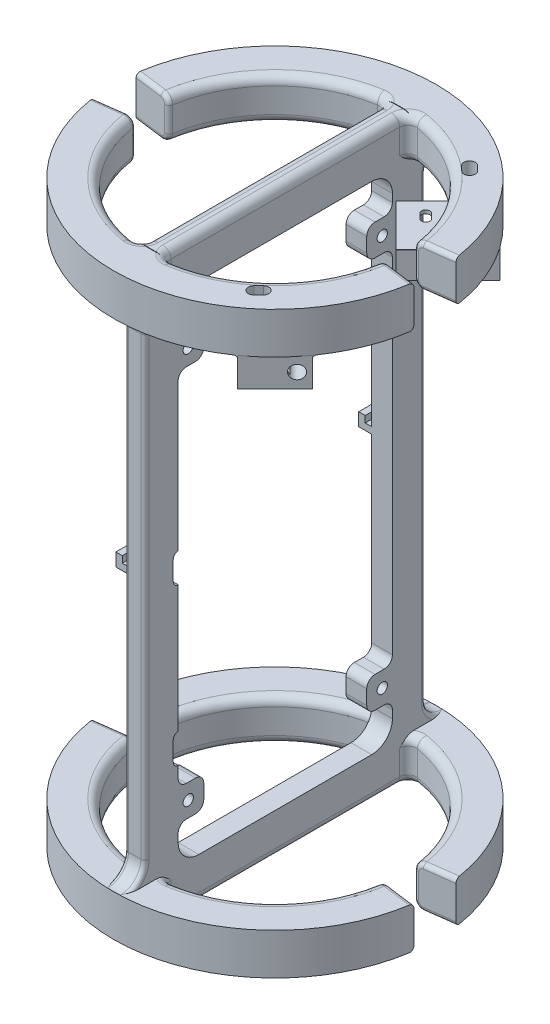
SolidWorks part; units mm, degrees
ref_plane "Front Plane" through (0, 0, 0) normal (0, 0, 1) x (1, 0, 0)
ref_plane "Top Plane" through (0, 0, 0) normal (0, 1, 0) x (1, 0, 0)
ref_plane "Right Plane" through (0, 0, 0) normal (1, 0, 0) x (0, 0, -1)
imported_body "20190209_Avionics_FrameV2-1-solid1"
imported_body "holderV2-2-solid1"
imported_body "holderV2-3-solid1"
combine bodies "Combine1" operation type add bodies to combine 103 101
combine bodies "Combine2" operation type add bodies to combine 102 104
sketch "Sketch3" plane through (0, 173.4347, 0) normal (0, -1, 0) x (-1, 0, 0)
  line L0 (-39.4151, -193.4782) -> (-41.214, -195.277) construction
  line L1 (-37.9783, -194.915) -> (-39.7743, -196.7111) construction
  line L2 (-39.7743, -196.7111) -> (-41.214, -195.277)
  line L3 (-37.9783, -194.915) -> (-39.4151, -193.4782)
  arc A1 (-39.4151, -193.4782) -> (-41.1403, -195.3451) centre (-40.3145, -194.3776) ccw construction
  arc A2 (-39.7743, -196.7111) -> (-37.9783, -194.915) centre (-38.8763, -195.813) ccw construction
  circle A3 centre (-40.3145, -194.3776) radius 1.272
  circle A4 centre (-38.8763, -195.813) radius 1.27
extrude "Cut-Extrude1" cut sketch "Sketch3" against normal blind 15 contours A4 A3 M5 | A4 A3 M6 | A4 A3 M3
sketch "Sketch4" plane through (0, 186.1347, 0) normal (0, 1, 0) x (1, 0, 0)
  line L0 (37.9783, -194.915) -> (39.7743, -196.7111) construction
  line L1 (41.1403, -195.3451) -> (39.4151, -193.4782) construction
  line L2 (39.7743, -196.7111) -> (40.1137, -197.0505)
  line L3 (37.9783, -194.915) -> (37.6389, -194.5756)
  line L4 (41.1403, -195.3451) -> (41.4654, -195.6969)
  line L5 (39.4151, -193.4782) -> (39.09, -193.1264)
  line L6 (37.6389, -194.5756) -> (39.09, -193.1264)
  line L7 (40.1137, -197.0505) -> (41.4654, -195.6969)
  circle A0 centre (40.2777, -194.4116) radius 1.75
  circle A1 centre (38.8763, -195.813) radius 1.75
  dimension "D1" = 3.5
  dimension "D2" = 3.5
extrude "Cut-Extrude2" cut sketch "Sketch4" against normal blind 5 contours A1 L7 A0 | L3 A1 L2 M4 | L2 A1 A0 M3 | A1 A0 L4 M3 | A0 A1 M3 | A0 A1 L3 M5 | A1 A0 L6 | L4 A0 L5 M2 | A1 A0 M5 | A1 L5 L6 A0 M5
sketch "Sketch8" plane through (0, 173.4347, 0) normal (0, -1, 0) x (-1, 0, 0)
  line L0 (-37.8885, -130.4266) -> (-39.6845, -128.6306) construction
  line L1 (-39.2544, -131.7926) -> (-41.1386, -130.085) construction
  line L2 (-37.8885, -130.4266) -> (-39.2544, -131.7926)
  line L3 (-39.6845, -128.6306) -> (-41.1386, -130.085)
  arc A0 (-37.8885, -130.4266) -> (-39.6845, -128.6306) centre (-38.7865, -129.5286) ccw construction
  arc A2 (-41.1214, -130.0674) -> (-39.2544, -131.7926) centre (-40.2219, -130.9668) ccw construction
  circle A3 centre (-38.7865, -129.5286) radius 1.27
  circle A4 centre (-40.1965, -130.9388) radius 1.2714
extrude "Cut-Extrude3" cut sketch "Sketch8" against normal blind 15 contours A4 A3 M3 | A4 A3 M4 | A3 A4 | L3 A4 A3 | A4 A3 L3
sketch "Sketch9" plane through (0, 186.1347, 0) normal (0, 1, 0) x (1, 0, 0)
  line L0 (39.6845, -128.6306) -> (37.8885, -130.4266) construction
  line L1 (39.2544, -131.7926) -> (41.1386, -130.085) construction
  line L2 (39.6845, -128.6306) -> (40.0239, -128.2912)
  line L3 (37.8885, -130.4266) -> (37.5491, -130.766)
  line L4 (41.1386, -130.085) -> (41.4932, -129.7636)
  line L5 (39.2544, -131.7926) -> (38.8998, -132.114)
  line L6 (40.0239, -128.2912) -> (41.4932, -129.7636)
  line L7 (37.5491, -130.766) -> (38.8998, -132.114)
  circle A0 centre (38.7865, -129.5286) radius 1.75
  circle A1 centre (40.1965, -130.9388) radius 1.75
  dimension "D1" = 3.5
  dimension "D2" = 3.5
extrude "Cut-Extrude4" cut sketch "Sketch9" against normal blind 5 contours L2 A0 L3 M3 | A1 L3 A0 M6 | A1 A0 L7 M13 | A0 A1 L5 M13 M6 | A1 A0 M6 | A1 L4 L5 M13 M5 | L6 A1 A0 L4 M4 | A1 L6 A0 | A0 A1 M4 | A1 A0 L2 M4
sketch "Sketch11" plane through (8.9463, 0, 0) normal (-1, 0, 0) x (0, 0, 1)
  line L0 (131.2599, 157.3692) -> (120.8459, 157.3692)
  line L1 (120.8459, 167.0847) -> (120.8459, 27.3847) construction
  line L2 (193.9979, 157.3692) -> (204.4059, 157.3692)
  line L3 (204.4059, 27.3847) -> (204.4059, 167.0847) construction
  line L4 (129.7359, 150.0667) -> (129.7359, 44.4027) construction
  line L5 (129.7359, 101.8692) -> (120.7359, 101.8692)
  line L6 (129.7359, 101.8692) -> (129.7359, 99.8692)
  line L7 (129.7359, 99.8692) -> (120.7359, 99.8692)
  line L8 (120.7359, 101.8692) -> (120.7359, 99.8692)
  line L11 (197.1725, 99.8692) -> (204.3027, 99.8692)
  line L12 (197.1725, 99.8692) -> (197.1725, 101.8692)
  line L13 (197.1725, 101.8692) -> (204.3027, 101.8692)
  line L14 (204.3027, 99.8692) -> (204.3027, 101.8692)
  circle A0 centre (132.8474, 157.3692) radius 1.5875 construction
  circle A1 centre (192.4104, 157.3692) radius 1.5875 construction
  dimension "D1" = 55.5
  dimension "D2" = 2
  dimension "D3" = 55.5
  dimension "D4" = 2
  dimension "D5" = 9
extrude "Boss-Extrude1" add sketch "Sketch11" along normal blind 4 contours L11 L14 L13 L12 | L5 L8 L7 L6
sketch "Sketch12" plane through (0, 101.8692, 0) normal (0, 1, 0) x (1, 0, 0)
  line L0 (4.9463, -129.7359) -> (8.9463, -129.7359) construction
  line L1 (4.9463, -120.7359) -> (6.9463, -120.7359)
  line L2 (4.9463, -120.7359) -> (4.9463, -129.7359)
  line L3 (4.9463, -129.7359) -> (6.9463, -129.7359)
  line L4 (6.9463, -120.7359) -> (6.9463, -129.7359)
  line L5 (4.9463, -204.3027) -> (8.9463, -204.3027) construction
  line L6 (4.9463, -197.1725) -> (6.9463, -197.1725)
  line L7 (4.9463, -197.1725) -> (4.9463, -204.3027)
  line L8 (4.9463, -204.3027) -> (6.9463, -204.3027)
  line L9 (6.9463, -197.1725) -> (6.9463, -204.3027)
  dimension "D1" = 2
extrude "Boss-Extrude2" add sketch "Sketch12" along normal blind 2
fillet "Fillet1" radius 1 4 edges at (37.7461, 173.4347, 199.7118) (49.2071, 173.4347, 188.2507) (37.7461, 173.4347, 125.5401) (49.2071, 173.4347, 137.0011)
